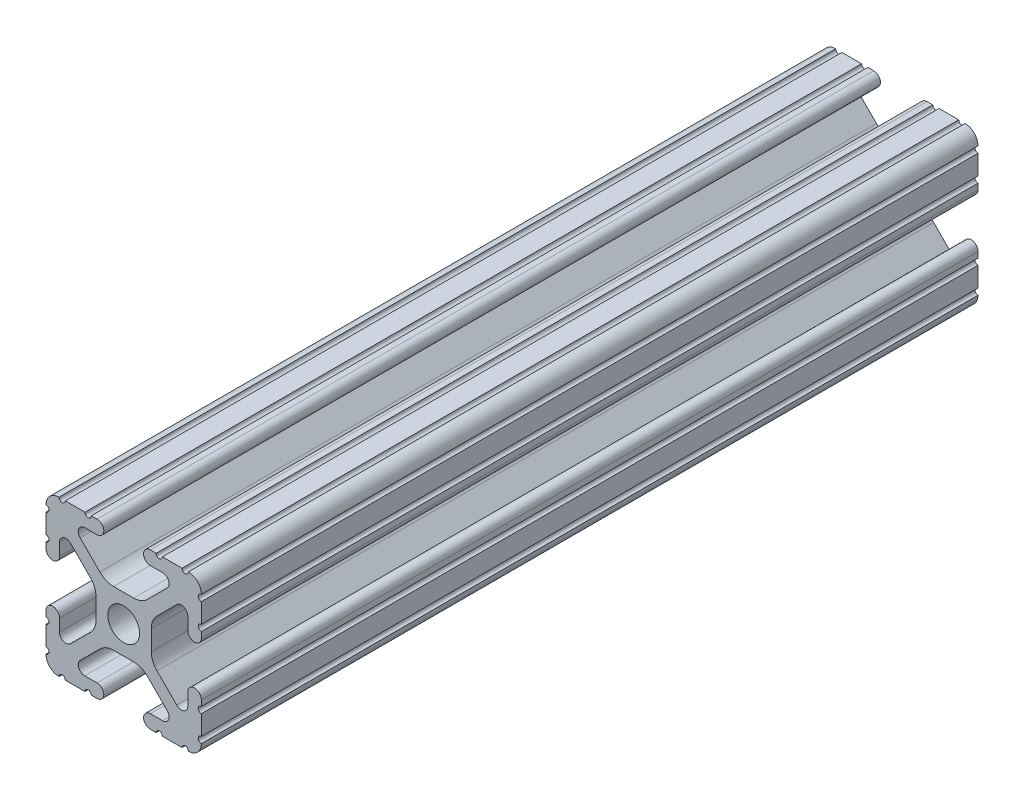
SolidWorks part; units mm, degrees
ref_plane "Front Plane" through (0, 0, 0) normal (0, 0, 1) x (1, 0, 0)
ref_plane "Top Plane" through (0, 0, 0) normal (0, 1, 0) x (1, 0, 0)
ref_plane "Right Plane" through (0, 0, 0) normal (1, 0, 0) x (0, 0, -1)
sketch "Sketch1" plane through (0, 0, 0) normal (0, 0, 1) x (1, 0, 0)
  line L0 (10.5918, 12.7) -> (10.5664, 12.7)
  line L1 (9.5504, 12.7) -> (6.3246, 12.7)
  line L2 (5.3086, 12.7) -> (4.3561, 12.7)
  line L3 (4.3561, 10.4902) -> (6.3701, 10.4902)
  line L4 (7.1192, 8.6817) -> (3.8846, 5.4471)
  line L5 (1.6396, 4.5172) -> (-1.6396, 4.5172)
  line L6 (-3.8846, 5.4471) -> (-7.1192, 8.6817)
  line L7 (-6.3701, 10.4902) -> (-4.3561, 10.4902)
  line L8 (-4.3561, 12.7) -> (-5.3086, 12.7)
  line L9 (-6.3246, 12.7) -> (-9.5504, 12.7)
  line L10 (-10.5664, 12.7) -> (-10.5918, 12.7)
  line L11 (-12.7, 10.5918) -> (-12.7, 10.5664)
  line L12 (-12.7, 9.5504) -> (-12.7, 6.3246)
  line L13 (-12.7, 5.3086) -> (-12.7, 4.3561)
  line L14 (-10.4902, 4.3561) -> (-10.4902, 6.3701)
  line L15 (-8.6817, 7.1192) -> (-5.4471, 3.8846)
  line L16 (-4.5172, 1.6396) -> (-4.5172, -1.6396)
  line L17 (-5.4471, -3.8846) -> (-8.6817, -7.1192)
  line L18 (-10.4902, -6.3701) -> (-10.4902, -4.3561)
  line L19 (-12.7, -4.3561) -> (-12.7, -5.3086)
  line L20 (-12.7, -6.3246) -> (-12.7, -9.5504)
  line L21 (-12.7, -10.5664) -> (-12.7, -10.5918)
  line L22 (-10.5918, -12.7) -> (-10.5664, -12.7)
  line L23 (-9.5504, -12.7) -> (-6.3246, -12.7)
  line L24 (-5.3086, -12.7) -> (-4.3561, -12.7)
  line L25 (-4.3561, -10.4902) -> (-6.3701, -10.4902)
  line L26 (-7.1192, -8.6817) -> (-3.8846, -5.4471)
  line L27 (-1.6396, -4.5172) -> (1.6396, -4.5172)
  line L28 (3.8846, -5.4471) -> (7.1192, -8.6817)
  line L29 (6.3701, -10.4902) -> (4.3561, -10.4902)
  line L30 (4.3561, -12.7) -> (5.3086, -12.7)
  line L31 (6.3246, -12.7) -> (9.5504, -12.7)
  line L32 (10.5664, -12.7) -> (10.5918, -12.7)
  line L33 (12.7, -10.5918) -> (12.7, -10.5664)
  line L34 (12.7, -9.5504) -> (12.7, -6.3246)
  line L35 (12.7, -5.3086) -> (12.7, -4.3561)
  line L36 (10.4902, -4.3561) -> (10.4902, -6.3701)
  line L37 (8.6817, -7.1192) -> (5.4471, -3.8846)
  line L38 (4.5172, -1.6396) -> (4.5172, 1.6396)
  line L39 (5.4471, 3.8846) -> (8.6817, 7.1192)
  line L40 (10.4902, 6.3701) -> (10.4902, 4.3561)
  line L41 (12.7, 4.3561) -> (12.7, 5.3086)
  line L42 (12.7, 6.3246) -> (12.7, 9.5504)
  line L43 (12.7, 10.5664) -> (12.7, 10.5918)
  circle A0 centre (0, 0) radius 2.6035
  arc A1 (12.7, 10.5918) -> (10.5918, 12.7) centre (10.5918, 10.5918) ccw
  arc A2 (9.5504, 12.7) -> (10.5664, 12.7) centre (10.0584, 12.7) ccw
  arc A3 (5.3086, 12.7) -> (6.3246, 12.7) centre (5.8166, 12.7) ccw
  arc A4 (4.3561, 12.7) -> (4.3561, 10.4902) centre (4.3561, 11.5951) ccw
  arc A5 (7.1192, 8.6817) -> (6.3701, 10.4902) centre (6.3701, 9.4308) ccw
  arc A6 (1.6396, 4.5172) -> (3.8846, 5.4471) centre (1.6396, 7.6922) ccw
  arc A7 (-3.8846, 5.4471) -> (-1.6396, 4.5172) centre (-1.6396, 7.6922) ccw
  arc A8 (-6.3701, 10.4902) -> (-7.1192, 8.6817) centre (-6.3701, 9.4308) ccw
  arc A9 (-4.3561, 10.4902) -> (-4.3561, 12.7) centre (-4.3561, 11.5951) ccw
  arc A10 (-6.3246, 12.7) -> (-5.3086, 12.7) centre (-5.8166, 12.7) ccw
  arc A11 (-10.5664, 12.7) -> (-9.5504, 12.7) centre (-10.0584, 12.7) ccw
  arc A12 (-10.5918, 12.7) -> (-12.7, 10.5918) centre (-10.5918, 10.5918) ccw
  arc A13 (-12.7, 9.5504) -> (-12.7, 10.5664) centre (-12.7, 10.0584) ccw
  arc A14 (-12.7, 5.3086) -> (-12.7, 6.3246) centre (-12.7, 5.8166) ccw
  arc A15 (-12.7, 4.3561) -> (-10.4902, 4.3561) centre (-11.5951, 4.3561) ccw
  arc A16 (-8.6817, 7.1192) -> (-10.4902, 6.3701) centre (-9.4308, 6.3701) ccw
  arc A17 (-4.5172, 1.6396) -> (-5.4471, 3.8846) centre (-7.6922, 1.6396) ccw
  arc A18 (-5.4471, -3.8846) -> (-4.5172, -1.6396) centre (-7.6922, -1.6396) ccw
  arc A19 (-10.4902, -6.3701) -> (-8.6817, -7.1192) centre (-9.4308, -6.3701) ccw
  arc A20 (-10.4902, -4.3561) -> (-12.7, -4.3561) centre (-11.5951, -4.3561) ccw
  arc A21 (-12.7, -6.3246) -> (-12.7, -5.3086) centre (-12.7, -5.8166) ccw
  arc A22 (-12.7, -10.5664) -> (-12.7, -9.5504) centre (-12.7, -10.0584) ccw
  arc A23 (-12.7, -10.5918) -> (-10.5918, -12.7) centre (-10.5918, -10.5918) ccw
  arc A24 (-9.5504, -12.7) -> (-10.5664, -12.7) centre (-10.0584, -12.7) ccw
  arc A25 (-5.3086, -12.7) -> (-6.3246, -12.7) centre (-5.8166, -12.7) ccw
  arc A26 (-4.3561, -12.7) -> (-4.3561, -10.4902) centre (-4.3561, -11.5951) ccw
  arc A27 (-7.1192, -8.6817) -> (-6.3701, -10.4902) centre (-6.3701, -9.4308) ccw
  arc A28 (-1.6396, -4.5172) -> (-3.8846, -5.4471) centre (-1.6396, -7.6922) ccw
  arc A29 (3.8846, -5.4471) -> (1.6396, -4.5172) centre (1.6396, -7.6922) ccw
  arc A30 (6.3701, -10.4902) -> (7.1192, -8.6817) centre (6.3701, -9.4308) ccw
  arc A31 (4.3561, -10.4902) -> (4.3561, -12.7) centre (4.3561, -11.5951) ccw
  arc A32 (6.3246, -12.7) -> (5.3086, -12.7) centre (5.8166, -12.7) ccw
  arc A33 (10.5664, -12.7) -> (9.5504, -12.7) centre (10.0584, -12.7) ccw
  arc A34 (10.5918, -12.7) -> (12.7, -10.5918) centre (10.5918, -10.5918) ccw
  arc A35 (12.7, -9.5504) -> (12.7, -10.5664) centre (12.7, -10.0584) ccw
  arc A36 (12.7, -5.3086) -> (12.7, -6.3246) centre (12.7, -5.8166) ccw
  arc A37 (12.7, -4.3561) -> (10.4902, -4.3561) centre (11.5951, -4.3561) ccw
  arc A38 (8.6817, -7.1192) -> (10.4902, -6.3701) centre (9.4308, -6.3701) ccw
  arc A39 (4.5172, -1.6396) -> (5.4471, -3.8846) centre (7.6922, -1.6396) ccw
  arc A40 (5.4471, 3.8846) -> (4.5172, 1.6396) centre (7.6922, 1.6396) ccw
  arc A41 (10.4902, 6.3701) -> (8.6817, 7.1192) centre (9.4308, 6.3701) ccw
  arc A42 (10.4902, 4.3561) -> (12.7, 4.3561) centre (11.5951, 4.3561) ccw
  arc A43 (12.7, 6.3246) -> (12.7, 5.3086) centre (12.7, 5.8166) ccw
  arc A44 (12.7, 10.5664) -> (12.7, 9.5504) centre (12.7, 10.0584) ccw
extrude "Extrude1" add sketch "Sketch1" against normal blind 127
